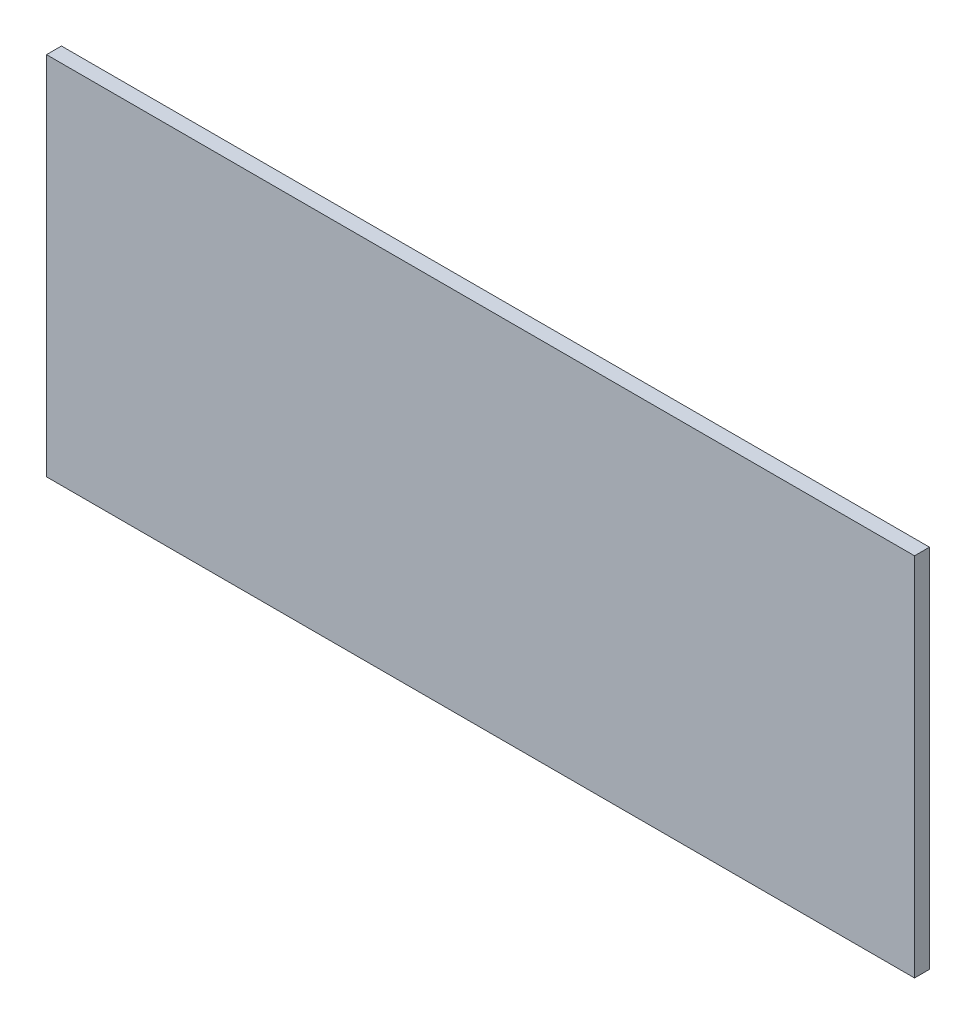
SolidWorks part; units mm, degrees
ref_plane "Plan de face" through (0, 0, 0) normal (0, 0, 1) x (1, 0, 0)
ref_plane "Plan de dessus" through (0, 0, 0) normal (0, 1, 0) x (1, 0, 0)
ref_plane "Plan de droite" through (0, 0, 0) normal (1, 0, 0) x (0, 0, -1)
sketch "Esquisse1" plane through (0, 0, 0) normal (0, 0, 1) x (1, 0, 0)
  line L21 (475.8611, 10.8879) -> (-104.1389, 10.8879)
  line L23 (475.8611, -233.4221) -> (-104.1389, -233.4221)
  line L24 (-104.1389, 10.8879) -> (-104.1389, -233.4221)
  line L26 (475.8611, -233.4221) -> (475.8611, 10.8879)
  dimension "D4" = 244.31
extrude "Boss.-Extru.1" add sketch "Esquisse1" along normal blind 10
